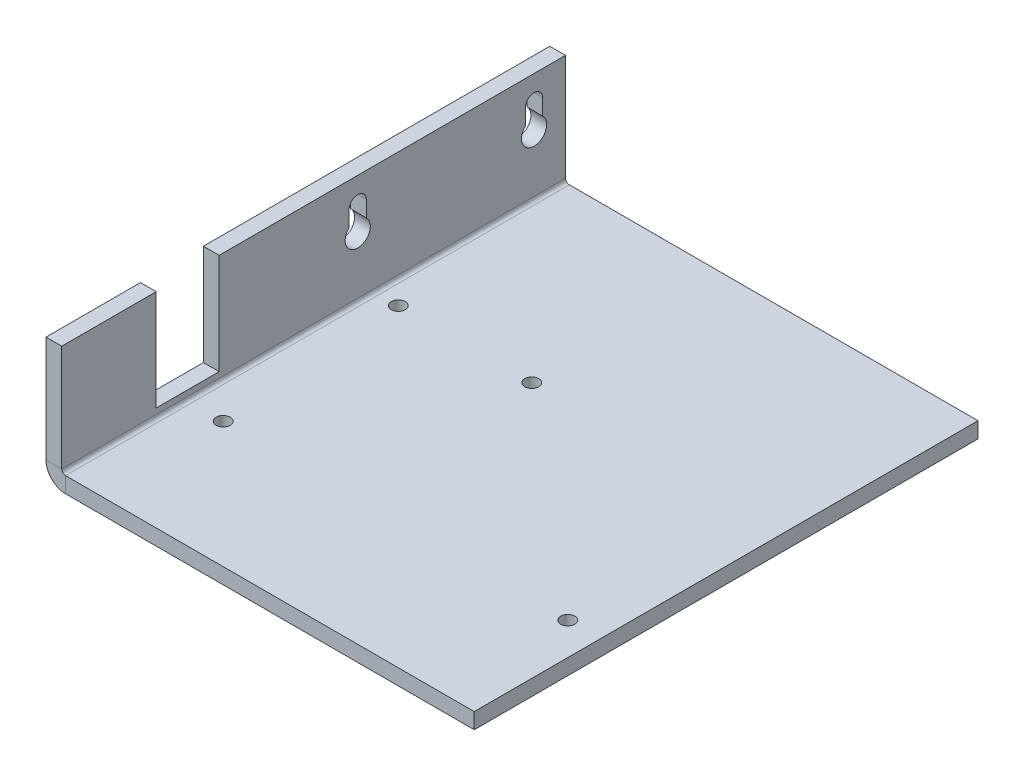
SolidWorks part; units mm, degrees
ref_plane "Front" through (0, 0, 0) normal (0, 0, 1) x (1, 0, 0)
ref_plane "Top" through (0, 0, 0) normal (0, 1, 0) x (1, 0, 0)
ref_plane "Right" through (0, 0, 0) normal (1, 0, 0) x (0, 0, -1)
sketch "Sketch1" plane through (0, 0, 0) normal (0, 0, 1) x (1, 0, 0)
  line L0 (-43.18, 0) -> (-43.18, 25.4)
  line L3 (-43.18, 0) -> (43.18, 0)
  dimension "D1" = 25.4
  dimension "D2" = 86.36
extrude "Base-Extrude-Thin" add sketch "Sketch1" against normal blind 101.6 thin
hole_wizard "#4-40 Tapped Hole2" positions "Sketch7" profile "Sketch6" tap size "#4-40" standard "Ansi Inch"
sketch "Sketch7" plane through (0, 3.175, 0) normal (0, 1, 0) x (-1, 0, 0)
  line L0 (-47.7032, -25.4) -> (50.0697, -25.4) construction
  line L2 (43.18, -101.6) -> (43.18, 0) construction
  line L3 (-50.6561, -63.246) -> (58.5492, -63.246) construction
  line L4 (32.8422, -15.6876) -> (32.8422, -123.6256) construction
  line L5 (40.005, 0) -> (-43.18, 0) construction
  point P0 (-36.6522, -25.4)
  point P7 (32.8422, -25.4)
  point P12 (8.4582, -63.246)
  point P13 (35.3822, -63.246)
  dimension "D1" = 25.4
  dimension "D2" = 10.3378
  dimension "D3" = 37.846
  dimension "D4" = 26.924
  dimension "D5" = 69.4944
  dimension "D6" = 7.7978
sketch "Sketch6" plane through (36.6522, 3.175, -25.4) normal (1, 0, 0) x (0, 0, 1)
  line L0 (0, 0) -> (0, 3.175)
  line L1 (0, 3.175) -> (1.1303, 3.175)
  line L3 (1.1303, 3.175) -> (1.1303, 5.6896)
  line L4 (1.1303, 5.6896) -> (1.4224, 5.6896)
  line L5 (1.4224, 5.6896) -> (1.4224, 0)
  line L7 (1.4224, 0) -> (0, 0)
  line L11 (0, -6.35) -> (0, 107.95) construction
  dimension "Thru Tap Drill Dia." = 2.2606
  dimension "Thru Tap Drill Depth" = 3.175
  dimension "Thread Dia." = 2.8448
  dimension "Thread Depth" = 5.6896
sheet metal parameters "Sheet-Metal1" parameters "D1"=0.762
bend "SharpBend1" bend angle 90 parameters "D1"=0, "D5"=1
flatten bends "Flatten-Bends1" parameters "D1"=0
sketch "Sharp-Sketch1" plane through (0, 3.175, 0) normal (0, 1, 0) x (-1, 0, 0)
  line L0 (41.0883, -101.6) -> (41.0883, 0) construction
process bends "Process-Bends1" parameters "D1"=0
sketch "Flat-Sketch1" plane through (0, 3.175, 0) normal (0, 1, 0) x (-1, 0, 0)
sketch "Sketch10" plane through (-40.005, 0, 0) normal (1, 0, 0) x (0, 0, -1)
  line L0 (-4.8028, 20.32) -> (104.9521, 20.32) construction
  line L1 (101.6, 25.4) -> (0, 25.4) construction
  line L2 (95.25, 30.9488) -> (95.25, -5.3514) construction
  line L4 (96.9772, 20.32) -> (96.9772, 17.1024)
  line L5 (93.5228, 20.32) -> (93.5228, 17.1024)
  line L6 (101.6, 25.4) -> (101.6, 3.937) construction
  line L8 (77.47, 40.7314) -> (77.47, -13.555) construction
  line L9 (61.4172, 20.32) -> (61.4172, 17.1024)
  line L10 (57.9628, 20.32) -> (57.9628, 17.1024)
  arc A0 (96.9772, 20.32) -> (93.5228, 20.32) centre (95.25, 20.32) ccw
  arc A1 (93.5228, 17.1024) -> (96.9772, 17.1024) centre (95.25, 15.24) ccw
  circle A2 centre (95.25, 20.32) radius 2.54 construction
  circle A3 centre (59.69, 20.32) radius 2.54 construction
  arc A4 (61.4172, 17.1024) -> (57.9628, 17.1024) centre (59.69, 15.24) cw
  arc A5 (57.9628, 20.32) -> (61.4172, 20.32) centre (59.69, 20.32) cw
  dimension "D2" = 3.4544
  dimension "D3" = 5.08
  dimension "D5" = 5.08
  dimension "D1" = 5.08
  dimension "D4" = 6.35
  dimension "D6" = 17.78
extrude "Cut-Extrude1" cut sketch "Sketch10" against normal through all
sketch "Sketch11" plane through (-43.18, 0, 0) normal (-1, 0, 0) x (0, 0, 1)
  line L0 (-25.4, 34.3811) -> (-25.4, -11.4378) construction
  line L1 (-25.4, 0) -> (-25.4, 3.175) construction
  line L2 (-31.75, 5.08) -> (-19.05, 45.72) construction
  line L3 (-31.75, 45.72) -> (-19.05, 45.72)
  line L4 (-31.75, 45.72) -> (-31.75, 5.08)
  line L5 (-31.75, 5.08) -> (-19.05, 5.08)
  line L6 (-19.05, 45.72) -> (-19.05, 5.08)
  line L7 (-101.6, 25.4) -> (0, 25.4) construction
  point P8 (-25.4, 25.4)
  dimension "D1" = 20.32
  dimension "D2" = 12.7
extrude "Cut-Extrude2" cut sketch "Sketch11" against normal through all
